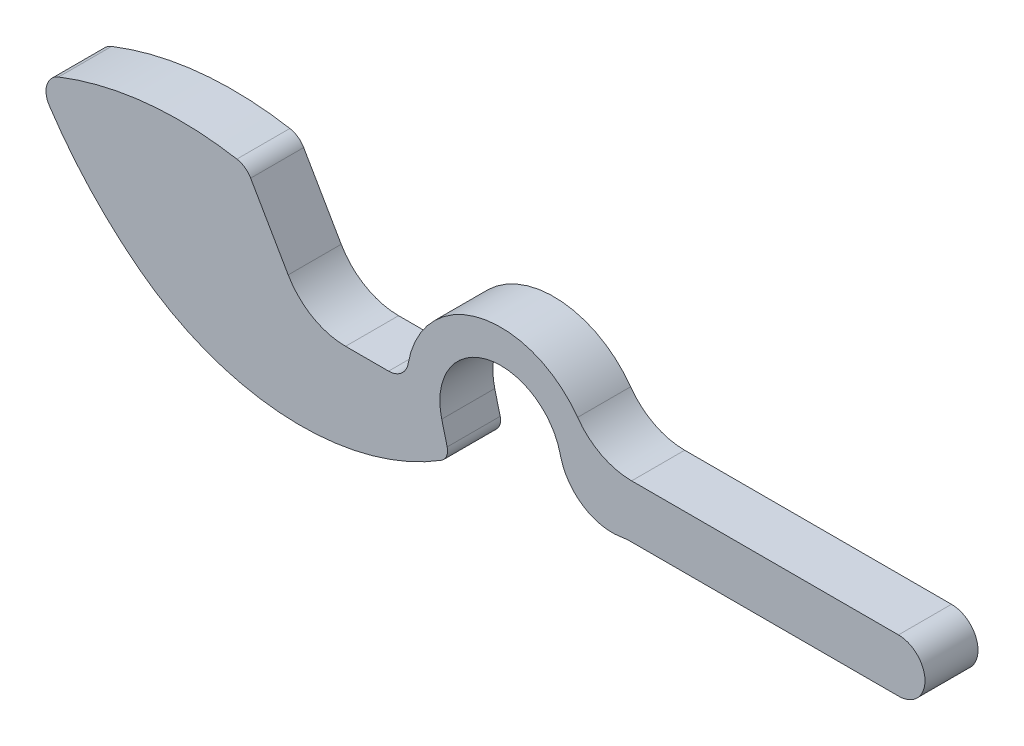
SolidWorks part; units mm, degrees
ref_plane "Plan de face" through (0, 0, 0) normal (0, 0, 1) x (1, 0, 0)
ref_plane "Plan de dessus" through (0, 0, 0) normal (0, 1, 0) x (1, 0, 0)
ref_plane "Plan de droite" through (0, 0, 0) normal (1, 0, 0) x (0, 0, -1)
ref_plane "Plan1" through (0, 0, 1) normal (0, 0, 1) x (1, 0, 0)
sketch "Esquisse3" plane through (0, 0, 1) normal (0, 0, 1) x (1, 0, 0)
  circle A1 centre (47.5, -47.5) radius 14.2
  circle A2 centre (47.5, -47.5) radius 9.2
  circle A3 centre (47.5, -47.5) radius 9.2
  dimension "D1" = 0.2
  dimension "D2" = 5
extrude "Boss.-Extru.2" add sketch "Esquisse3" along normal offset from surface (8 mm away) 1
sketch "Esquisse4" plane through (0, 0, 9) normal (0, 0, 1) x (1, 0, 0)
  line L0 (0, 0) -> (0, -30.5) construction
  line L1 (27.5, -30.5) -> (27.5, -37.5) construction
  line L3 (-37.5, -37.5) -> (37.5, -37.5) construction
  line L4 (67.2393, -43.5) -> (107.5, -43.5)
  line L6 (30.5636, -47.5) -> (24.0735, -47.5)
  line L7 (15.4132, -42.5) -> (9.7503, -32.6915)
  line L8 (-25, -30.5) -> (25, -30.5) construction
  line L9 (47.5, -47.5) -> (125.8857, -47.5) construction
  line L10 (67.2393, -51.5) -> (107.5, -51.5)
  circle A0 centre (47.5, -47.5) radius 50.4505 construction
  circle A1 centre (47.5, -47.5) radius 14.2 construction
  arc A2 (53.0901, -60.5534) -> (59.0826, -55.7149) centre (47.5, -47.5) ccw
  arc A3 (7.6681, -31.2362) -> (-19.2296, -33.9604) centre (-0.93, -80.4914) ccw
  arc A4 (-20.6369, -38.4025) -> (53.0901, -60.5534) centre (29.4701, -5.3982) ccw
  arc A5 (24.0735, -47.5) -> (15.4132, -42.5) centre (24.0735, -37.5) cw
  arc A6 (59.0826, -39.2851) -> (33.5177, -45.0233) centre (47.5, -47.5) ccw
  arc A7 (-20.6369, -38.4025) -> (-19.2296, -33.9604) centre (-18.1316, -36.7523) cw
  arc A8 (9.7503, -32.6915) -> (7.6681, -31.2362) centre (7.1522, -34.1915) ccw
  arc A9 (59.0826, -39.2851) -> (67.2393, -43.5) centre (67.2393, -33.5) ccw
  arc A10 (30.5636, -47.5) -> (33.5177, -45.0233) centre (30.5636, -44.5) ccw
  arc A14 (67.2393, -51.5) -> (59.0826, -55.7149) centre (67.2393, -61.5) ccw
  arc A15 (107.5, -51.5) -> (107.5, -43.5) centre (107.5, -47.5) ccw
  circle A21 centre (47.5, -47.5) radius 9.2 construction
  circle A22 centre (47.5, -47.5) radius 9.2
  point P14 (47.5, 47.5)
  point P29 (18.3, -47.5)
  point P30 (63.7, 47.5)
  point P33 (-22.5, -35.3833)
  point P36 (9.0624, -31.5)
  point P37 (61.125, -43.5)
  point P42 (33.3, -47.5)
  point P49 (53.4291, 49.3127)
  point P50 (47.5, 47.5)
  dimension "D1" = 4
  dimension "D5" = 100
  dimension "D6" = 70
  dimension "D7" = 10
  dimension "D8" = 10
  dimension "D9" = 3
  dimension "D12" = 60
  dimension "D13" = 60
  dimension "D10" = 10
  dimension "D11" = 3
  dimension "D2" = 15
  dimension "D3" = 120
  dimension "D4" = 1
extrude "Boss.-Extru.3" add sketch "Esquisse4" against normal up to surface (8 mm away)
sketch "Esquisse5" plane through (0, 0, 9) normal (0, 0, 1) x (1, 0, 0)
  line L0 (47.5, -47.5) -> (51.4272, -62.9391) construction
  line L1 (38.5839, -49.768) -> (42.2116, -64.0297)
  line L2 (56.4161, -45.232) -> (59.0826, -55.7149)
  circle A4 centre (47.5, -47.5) radius 9.2 construction
  arc A6 (56.4161, -45.232) -> (38.5839, -49.768) centre (47.5, -47.5) ccw
  arc A11 (-20.6369, -38.4025) -> (53.0901, -60.5534) centre (29.4701, -5.3982) ccw construction
  arc A12 (42.2116, -64.0297) -> (53.0901, -60.5534) centre (29.4701, -5.3982) ccw
  arc A13 (53.0901, -60.5534) -> (59.0826, -55.7149) centre (47.5, -47.5) ccw construction
  arc A14 (53.0901, -60.5534) -> (59.0826, -55.7149) centre (47.5, -47.5) ccw
extrude "Enlèv. mat.-Extru.2" cut sketch "Esquisse5" against normal through all
fillet "Congé2" radius 8 2 edges at (59.0826, -55.7149, 5) (42.2116, -64.0297, 5)
sketch "Esquisse7" plane through (0, 0, 9) normal (0, 0, 1) x (1, 0, 0)
  line L3 (38.5839, -49.768) -> (40.0042, -55.3516) construction
  line L4 (39.7553, -54.3728) -> (40.0042, -55.3516)
  arc A0 (-7.0374, -53.0134) -> (39.7553, -54.3728) centre (17.301, -21.2699) ccw
  arc A1 (-20.6369, -38.4025) -> (32.679, -65.3123) centre (29.4701, -5.3982) ccw construction
  circle A2 centre (47.5, -47.5) radius 9 construction
  arc A4 (32.679, -65.3123) -> (40.0042, -55.3516) centre (32.2511, -57.3238) ccw construction
  arc A5 (32.679, -65.3123) -> (40.0042, -55.3516) centre (32.2511, -57.3238) ccw
  arc A6 (-7.0374, -53.0134) -> (32.679, -65.3123) centre (29.4701, -5.3982) ccw
  dimension "D1" = 40
  dimension "D2" = 80
extrude "Enlèv. mat.-Extru.3" cut sketch "Esquisse7" against normal through all
fillet "Congé5" radius 2 1 edges at (39.7553, -54.3728, 5)
